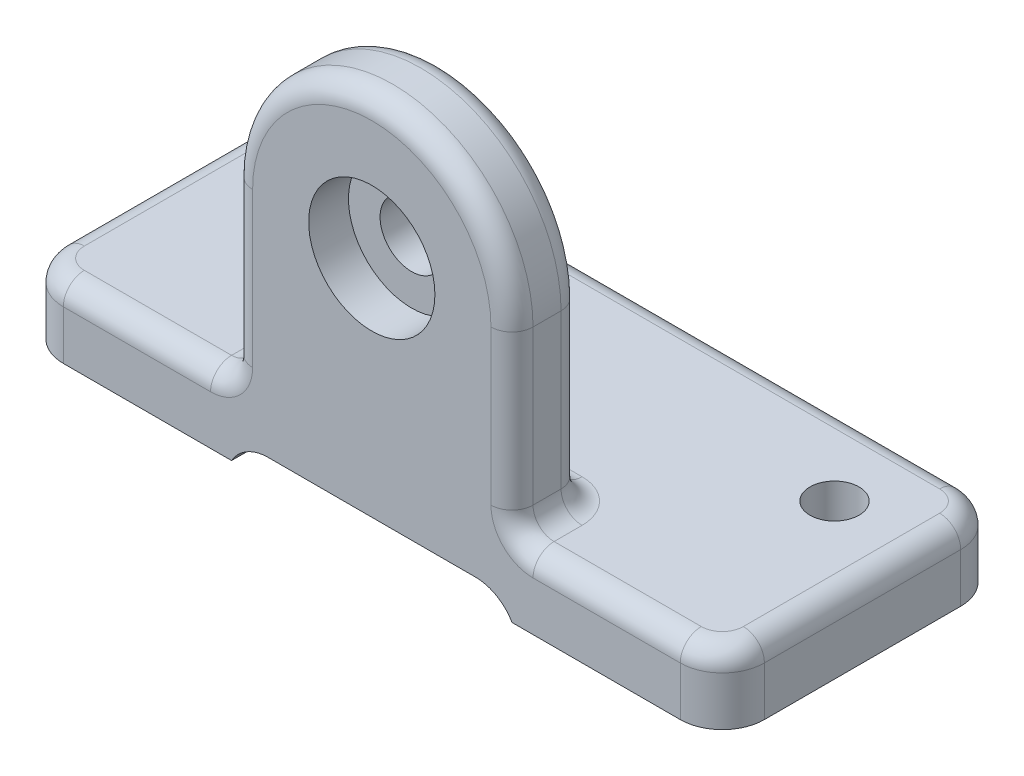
SolidWorks part; units mm, degrees
ref_plane "Front Plane" through (0, 0, 0) normal (0, 0, 1) x (1, 0, 0)
ref_plane "Top Plane" through (0, 0, 0) normal (0, 1, 0) x (1, 0, 0)
ref_plane "Right Plane" through (0, 0, 0) normal (1, 0, 0) x (0, 0, -1)
sketch "Sketch1" plane through (0, 0, 0) normal (0, 1, 0) x (1, 0, 0)
  line L1 (0, 0) -> (100, 0)
  line L2 (0, 0) -> (0, 40)
  line L3 (0, 40) -> (100, 40)
  line L4 (100, 0) -> (100, 40)
  dimension "D1" = 100
  dimension "D2" = 40
extrude "Base Plate" add sketch "Sketch1" along normal blind 10
sketch "Sketch2" plane through (0, 0, 0) normal (0, 0, 1) x (1, 0, 0)
  line L0 (30, 0) -> (30, 35)
  line L1 (0, 0) -> (100, 0) construction
  line L2 (70, 35) -> (70, 0)
  line L3 (70, 0) -> (30, 0)
  line L4 (0, 10) -> (0, 0) construction
  arc A0 (30, 35) -> (70, 35) centre (50, 35) cw
  dimension "D1" = 20
  dimension "D2" = 50
  dimension "D3" = 35
extrude "Vert Boss" add sketch "Sketch2" against normal blind 10
sketch "Sketch5" plane through (0, 0, 0) normal (0, 0, 1) x (1, 0, 0)
  line L0 (0, 0) -> (100, 0) construction
  line L1 (30, 0) -> (70, 0)
  line L2 (30, 0) -> (30, 3)
  line L3 (30, 3) -> (70, 3)
  line L4 (70, 0) -> (70, 3)
  line L5 (30, 35) -> (30, 10) construction
  line L6 (70, 10) -> (70, 35) construction
  dimension "D1" = 3
extrude "Slot" cut sketch "Sketch5" against normal through all
hole_wizard "Ø7.0 (7) Diameter Hole1" positions "Sketch9" profile "Sketch8" hole size "Ø7.0" standard "Ansi Metric"
sketch "Sketch9" plane through (0, 10, 0) normal (0, 1, 0) x (-1, 0, 0)
  line L0 (-100, 0) -> (-100, -40) construction
  line L1 (-100, -40) -> (0, -40) construction
  line L2 (0, -40) -> (0, 0) construction
  point P0 (-88, -28)
  point P1 (-12, -28)
  dimension "D1" = 12
  dimension "D2" = 12
  dimension "D3" = 12
sketch "Sketch8" plane through (88, 10, -28) normal (1, 0, 0) x (0, 0, 1)
  line L0 (0, 0) -> (0, 10)
  line L1 (0, 10) -> (3.5, 10)
  line L2 (3.5, 10) -> (3.5, 0)
  line L5 (3.5, 0) -> (0, 0)
  line L11 (0, -6.35) -> (0, 107.95) construction
  dimension "Thru Hole Dia." = 7
  dimension "Thru Hole Depth" = 10
hole_wizard "CBORE for M8 Hex Head Bolt1" positions "Sketch4" profile "Sketch3" counterbore size "M8" standard "Ansi Metric"
sketch "Sketch4" plane through (0, 0, 0) normal (0, 0, 1) x (1, 0, 0)
  point P0 (50, 35)
sketch "Sketch3" plane through (50, 35, 0) normal (1, 0, 0) x (0, -1, 0)
  line L0 (0, 0) -> (0, 40)
  line L1 (0, 40) -> (4.5, 40)
  line L3 (4.5, 40) -> (4.5, 5.68)
  line L4 (4.5, 5.68) -> (9.005, 5.68)
  line L5 (9.005, 5.68) -> (9.005, 0)
  line L7 (9.005, 0) -> (0, 0)
  line L11 (0, -6.35) -> (0, 107.95) construction
  dimension "Thru Hole Dia." = 9
  dimension "Thru Hole Depth" = 40
  dimension "C'Bore Dia." = 18.01
  dimension "C'Bore Depth" = 5.68
fillet "Fillet1" radius 6 6 edges at (70, 3, -20) (30, 3, -20) (0, 5, 0) (0, 5, -40) (100, 5, -40) (100, 5, 0)
fillet "Fillet2" radius 3 18 edges at (1.7574, 10, -38.2426) (0, 10, -20) (50, 10, -40) (1.7574, 10, -1.7574) (98.2426, 10, -38.2426) (18, 10, 0) (100, 10, -20) (30, 10, -5) (98.2426, 10, -1.7574) (50, 10, -10) (82, 10, 0) (70, 22.5, -10) (30, 22.5, -10) (70, 22.5, 0) (30, 22.5, 0) (70, 10, -5) (50, 55, -10) (50, 55, 0)
